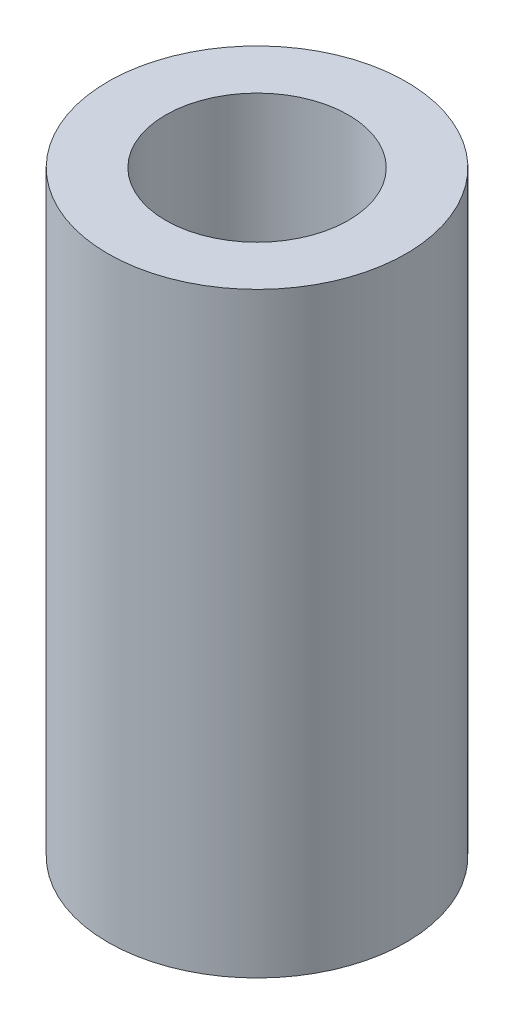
SolidWorks part; units mm, degrees
ref_plane "Front Plane" through (0, 0, 0) normal (0, 0, 1) x (1, 0, 0)
ref_plane "Top Plane" through (0, 0, 0) normal (0, 1, 0) x (1, 0, 0)
ref_plane "Right Plane" through (0, 0, 0) normal (1, 0, 0) x (0, 0, -1)
sketch "Sketch1" plane through (0, 0, 0) normal (0, 1, 0) x (1, 0, 0)
  circle A0 centre (0, 0) radius 2.375
  circle A1 centre (0, 0) radius 3.875
  dimension "D1" = 4.75
  dimension "D2" = 1.5
extrude "Boss-Extrude1" add sketch "Sketch1" along normal blind 15.5
